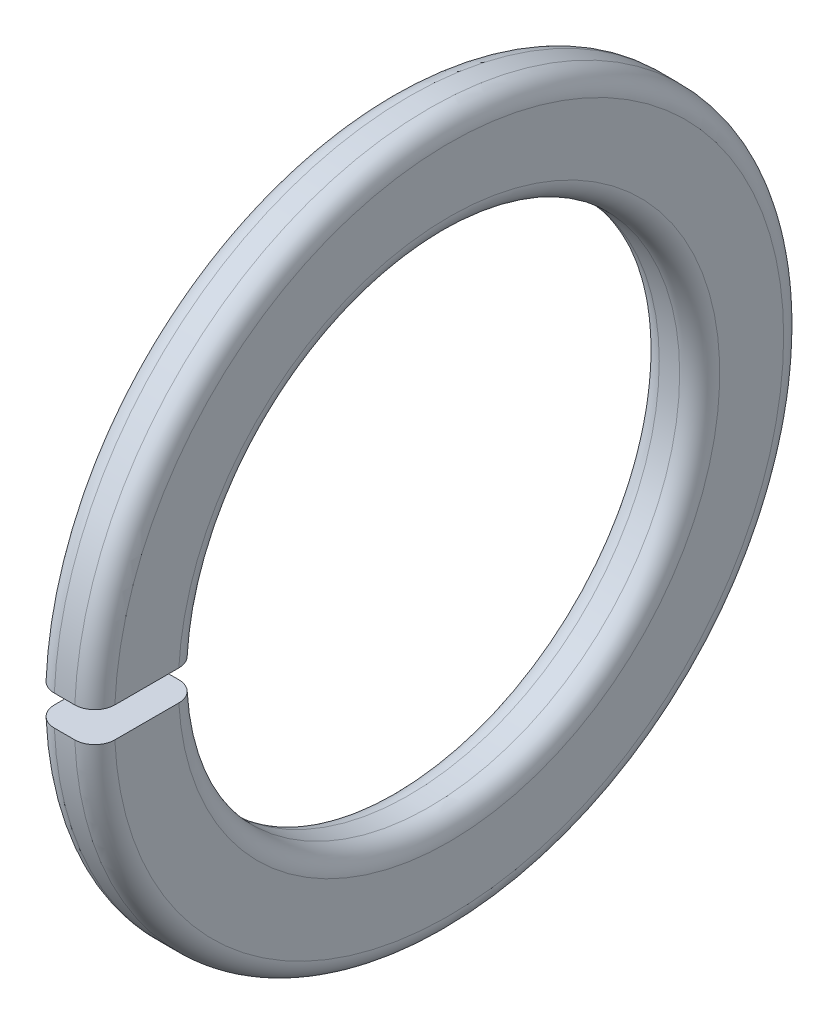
SolidWorks part; units mm, degrees
ref_plane "Plane1" through (0, 0, 0) normal (0, 0, 1) x (1, 0, 0)
ref_plane "Plane2" through (0, 0, 0) normal (0, 1, 0) x (1, 0, 0)
ref_plane "Plane3" through (0, 0, 0) normal (1, 0, 0) x (0, 0, -1)
sketch "Sketch1" plane through (0, 0, 0) normal (0, 0, 1) x (1, 0, 0)
  line L0 (-34.925, 0) -> (9.525, 0) construction
  line L1 (0, 35.8) -> (0, 44.25)
  line L2 (-2.65, 46.9) -> (-5.35, 46.9)
  line L3 (-8, 44.25) -> (-8, 35.8)
  line L4 (-5.35, 33.15) -> (-2.65, 33.15)
  arc A0 (-5.35, 33.15) -> (-8, 35.8) centre (-5.35, 35.8) cw
  arc A1 (0, 35.8) -> (-2.65, 33.15) centre (-2.65, 35.8) cw
  arc A2 (0, 44.25) -> (-2.65, 46.9) centre (-2.65, 44.25) ccw
  arc A3 (-5.35, 46.9) -> (-8, 44.25) centre (-5.35, 44.25) ccw
  point P8 (-8, 33.15)
  point P14 (0, 46.9)
  point P17 (-8, 46.9)
  dimension "Fillet_rad" = 2.65
  dimension "Thickness" = 8
  dimension "Inside_dia" = 66.3
  dimension "Outside_dia" = 93.8
revolve "Base-Revolve" add sketch "Sketch1" angle 360 about L0
sketch "Sketch2" plane through (0, 0, 0) normal (-1, 0, 0) x (0, -1, 0)
  line L0 (-2, 0) -> (2, 0)
  line L1 (0, 0) -> (0, 12.7) construction
  line L2 (2, 0) -> (2, 47.838)
  line L3 (2, 47.838) -> (-2, 47.838)
  line L4 (-2, 47.838) -> (-2, 0)
  dimension "D1" = 4
  dimension "D2" = 47.838
extrude "Gap" cut sketch "Sketch2" along normal through all
equation "\"D1@Sketch2\" = \"Thickness@Sketch1\" * 0.5"
equation "\"D2@Sketch2\" = \"Outside_dia@Sketch1\" * 0.51"
